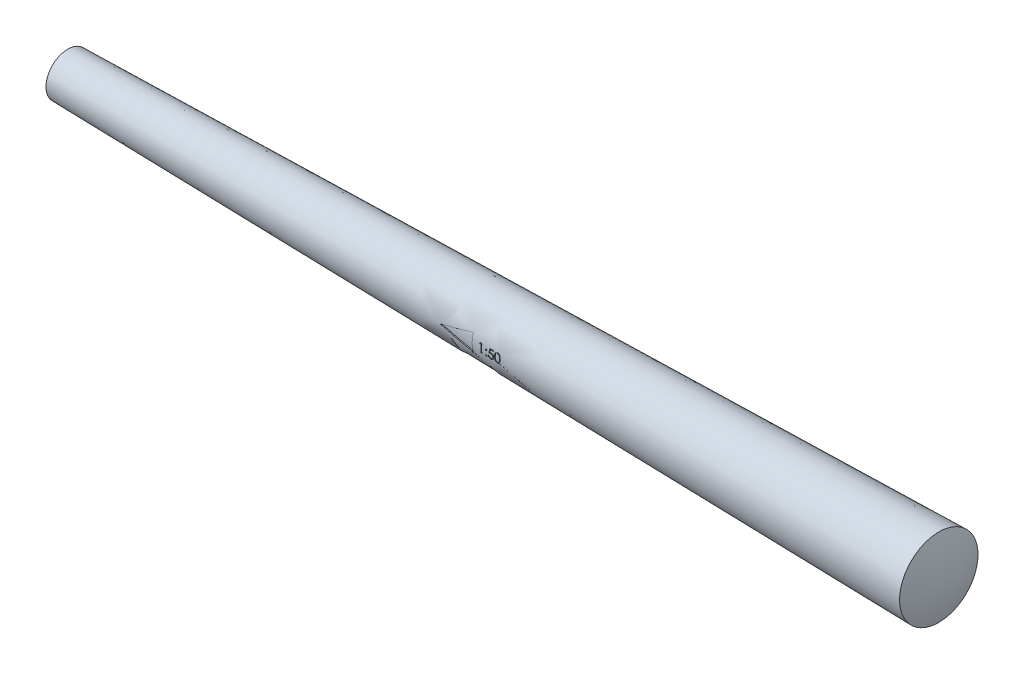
SolidWorks part; units mm, degrees
ref_plane "Front Plane" through (0, 0, 0) normal (0, 0, 1) x (1, 0, 0)
ref_plane "Top Plane" through (0, 0, 0) normal (0, 1, 0) x (1, 0, 0)
ref_plane "Right Plane" through (0, 0, 0) normal (1, 0, 0) x (0, 0, -1)
sketch "Sketch1" plane through (0, 0, 0) normal (1, 0, 0) x (0, 0, -1)
  circle A0 centre (0, 0) radius 2.5
  dimension "D1" = 5
extrude "Extrude1" add sketch "Sketch1" along normal mid plane 100
draft "Draft1" type of draft neutral plane draft angle 1.146 faces to draft 1 parameters "D1"=1.146
sketch "Sketch2" plane through (0, 0, 0) normal (0, 0, 1) x (1, 0, 0)
  line L0 (-50, 0) -> (-50, 2.5)
  line L1 (-50, 2.5) -> (-50, -2.5) construction
  line L2 (-50, 0) -> (-50.75, 0)
  line L3 (-50.75, 0) -> (-50.75, -3.5) construction
  line L4 (50, 0) -> (50, 4.5001)
  line L5 (50, -4.5001) -> (50, 4.5001) construction
  line L6 (50, 0) -> (50.75, 0)
  line L7 (50.75, 0) -> (50.75, -3.5) construction
  line L8 (-50, -2.5) -> (50, -4.5001) construction
  arc A0 (-50.75, 0) -> (-50, 2.5) centre (-46.2083, 0) cw
  arc A1 (50.75, 0) -> (50, 4.5001) centre (36.8746, 0) ccw
  point P14 (0, -3.5)
revolve "Revolve1" add sketch "Sketch2" angle 360 about L2
sketch "Sketch5" plane through (0, 0, 0) normal (0, 0, 1) x (1, 0, 0)
  line L0 (0, 3.5) -> (0, -3.5) construction
  line L1 (50, 4.5001) -> (-50, 2.5) construction
  line L2 (-50, -2.5) -> (50, -4.5001) construction
ref_plane "Plane2" through (0, 0, 0) normal (-0.02, 0, 0.9998) x (0.9998, 0, 0.02)
sketch "Sketch6" plane through (0, 0, 0) normal (-0.02, 0, 0.9998) x (0.9998, 0, 0.02)
  line L0 (0, 0) -> (0, 1)
  line L1 (0, 3.5) -> (0, -3.5) construction
  line L2 (0, 1) -> (-3.7321, 0)
  line L3 (-3.7321, 0) -> (0, -1)
  line L4 (0, -1) -> (0, 0)
  line L5 (0, -0.5) -> (4, -0.5) construction
  text T0 "1:50" font "Century Gothic" height 1
  dimension "D1" = 2
  dimension "D2" = 30
  dimension "D3" = 4
wrap "Wrap2" sketch "Sketch6" wrap type deboss source sketch "Sketch6" thickness 0.1 parameters "D1"=0.1
equation "\"D2@Sketch2\" = \"D1@Sketch2\""
